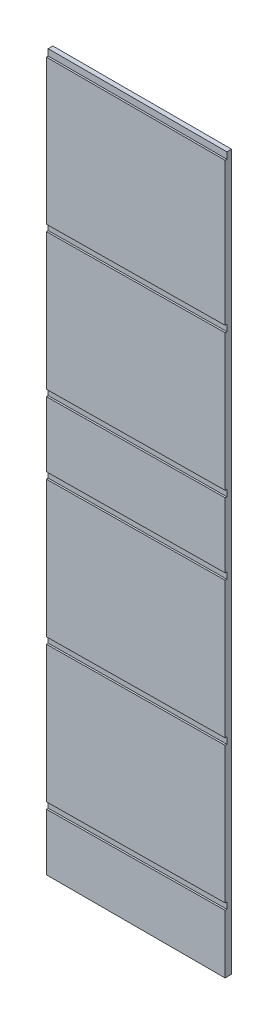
SolidWorks part; units mm, degrees
ref_plane "Plano frontal" through (0, 0, 0) normal (0, 0, 1) x (1, 0, 0)
ref_plane "Plano superior" through (0, 0, 0) normal (0, 1, 0) x (1, 0, 0)
ref_plane "Plano direito" through (0, 0, 0) normal (1, 0, 0) x (0, 0, -1)
sketch "Esboço1" plane through (0, 0, 0) normal (0, 0, 1) x (1, 0, 0)
  line L0 (0, -1000) -> (0, 49000) construction
  line L1 (250, -1000) -> (250, 49000) construction
  line L2 (-250, -1000) -> (-250, 49000) construction
  line L3 (-1000, 0) -> (49000, 0) construction
  line L4 (-1000, 1000) -> (49000, 1000) construction
  line L5 (-1000, -1000) -> (49000, -1000) construction
  line L7 (-250, 1000) -> (250, 1000)
  line L8 (-250, 1000) -> (-250, -1000)
  line L9 (-250, -1000) -> (250, -1000)
  line L10 (250, 1000) -> (250, -1000)
  line L11 (-250, 1000) -> (250, -1000) construction
  line L12 (-250, -1000) -> (250, 1000) construction
  point P4 (0, 0)
  point P5 (0, 0)
  point P7 (0.1193, 5.5071)
  point P10 (0, 0)
  point P21 (0, 0)
  dimension "D1" = 250
  dimension "D2" = 250
  dimension "D3" = 1000
  dimension "D4" = 1000
extrude "Ressalto-extrusão1" add sketch "Esboço1" along normal blind 18
sketch "Esboço2" plane through (0, 0, 18) normal (0, 0, 1) x (1, 0, 0)
  line L0 (-972.6062, 1000) -> (49027.3938, 1000) construction
  line L1 (-250, 0) -> (-250, 50000) construction
  line L2 (-972.6062, 982) -> (49027.3938, 982) construction
  line L3 (-972.6062, 582) -> (49027.3938, 582) construction
  line L4 (-972.6062, 564) -> (49027.3938, 564) construction
  line L5 (-972.6062, 182) -> (49027.3938, 182) construction
  line L6 (-972.6062, 164) -> (49027.3938, 164) construction
  line L7 (-972.6062, -18) -> (49027.3938, -18) construction
  line L8 (-972.6062, -36) -> (49027.3938, -36) construction
  line L9 (-972.6062, -418) -> (49027.3938, -418) construction
  line L10 (-972.6062, -436) -> (49027.3938, -436) construction
  line L11 (-972.6062, -818) -> (49027.3938, -818) construction
  line L12 (-972.6062, -836) -> (49027.3938, -836) construction
  line L13 (-972.6062, 977) -> (49027.3938, 977) construction
  line L14 (250, -42.997) -> (250, 49957.003) construction
  line L15 (-972.6062, 995) -> (49027.3938, 995) construction
  line L16 (250, 1000) -> (-250, 1000)
  line L17 (-250, 1000) -> (-250, 982)
  line L18 (-250, 982) -> (250, 982)
  line L19 (250, 982) -> (250, 1000)
  line L20 (-972.6062, 577) -> (49027.3938, 577) construction
  line L21 (-972.6062, 559) -> (49027.3938, 559) construction
  line L22 (250, 582) -> (-250, 577)
  line L23 (-250, 577) -> (-250, 559)
  line L24 (-250, 559) -> (250, 564)
  line L25 (250, 564) -> (250, 582)
  line L26 (-972.6062, 177) -> (49027.3938, 177) construction
  line L27 (-972.6062, 159) -> (49027.3938, 159) construction
  line L28 (250, 182) -> (-250, 177)
  line L29 (-250, 177) -> (-250, 159)
  line L30 (-250, 159) -> (250, 164)
  line L31 (250, 164) -> (250, 182)
  line L32 (-972.6062, -23) -> (49027.3938, -23) construction
  line L33 (-972.6062, -41) -> (49027.3938, -41) construction
  line L34 (-972.6062, -423) -> (49027.3938, -423) construction
  line L35 (-972.6062, -441) -> (49027.3938, -441) construction
  line L36 (-972.6062, -823) -> (49027.3938, -823) construction
  line L37 (-972.6062, -841) -> (49027.3938, -841) construction
  line L38 (250, -18) -> (-250, -23)
  line L39 (-250, -23) -> (-250, -41)
  line L40 (-250, -41) -> (250, -36)
  line L41 (250, -36) -> (250, -18)
  line L42 (250, -418) -> (-250, -423)
  line L43 (-250, -423) -> (-250, -441)
  line L44 (-250, -441) -> (250, -436)
  line L45 (250, -436) -> (250, -418)
  line L46 (250, -818) -> (-250, -823)
  line L47 (-250, -823) -> (-250, -841)
  line L48 (-250, -841) -> (250, -836)
  line L49 (250, -836) -> (250, -818)
  point P75 (-250, 1000)
  dimension "D1" = 5
  dimension "D2" = 5
  dimension "D3" = 5
  dimension "D4" = 5
  dimension "D5" = 5
  dimension "D6" = 5
  dimension "D8" = 5
extrude "Corte-extrusão1" cut sketch "Esboço2" against normal blind 5
other "Salvar corpos1"
ref_plane "Plano2" through (0, 0, 518) normal (0, 0, 1) x (1, 0, 0)
mirror "Espelhar13" about plane through (0, 0, 518) normal (0, 0, 1)
other "Salvar corpos2"
